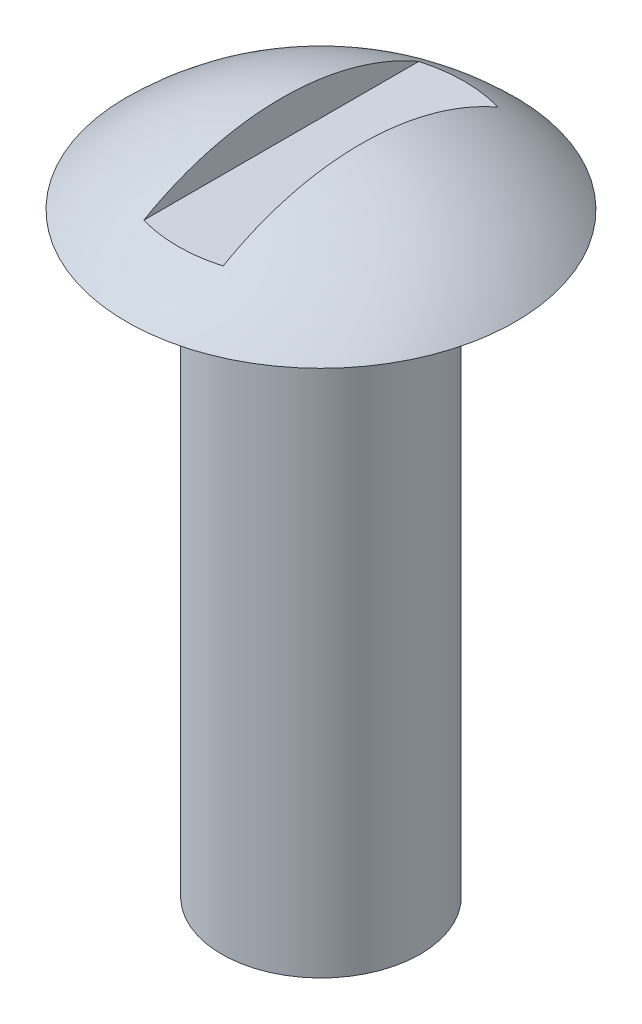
SolidWorks part; units mm, degrees
ref_plane "Plan de face" through (0, 0, 0) normal (0, 0, 1) x (1, 0, 0)
ref_plane "Plan de dessus" through (0, 0, 0) normal (0, 1, 0) x (1, 0, 0)
ref_plane "Plan de droite" through (0, 0, 0) normal (1, 0, 0) x (0, 0, -1)
sketch "Esquisse1" plane through (0, 0, 0) normal (0, 0, 1) x (1, 0, 0)
  line L0 (0, 0) -> (0, 15)
  line L1 (0, 15) -> (2.399, 15)
  line L2 (-2.5, 24.7117) -> (-2.5, -7.7139) construction
  line L3 (-2.5, 17) -> (-2.5, 0)
  line L4 (-2.5, 0) -> (0, 0)
  arc A0 (2.399, 15) -> (-2.5, 17) centre (-2.5, 10) ccw
  dimension "D3" = 7
  dimension "D4" = 10
  dimension "D1" = 2.5
  dimension "D2" = 15
revolve "Révolution1" add sketch "Esquisse1" angle 360 about L2
sketch "Esquisse2" plane through (0, 0, 0) normal (0, 0, 1) x (1, 0, 0)
  line L0 (-5, 15) -> (0, 15) construction
  line L1 (-3.5, 24.0065) -> (-1.5, 24.0065)
  line L2 (-3.5, 24.0065) -> (-3.5, 16)
  line L3 (-3.5, 16) -> (-1.5, 16)
  line L4 (-1.5, 24.0065) -> (-1.5, 16)
  dimension "D1" = 2
  dimension "D2" = 1.5
  dimension "D3" = 1
extrude "Enlèv. mat.-Extru.1" cut sketch "Esquisse2" against normal through all both and the other way through all
